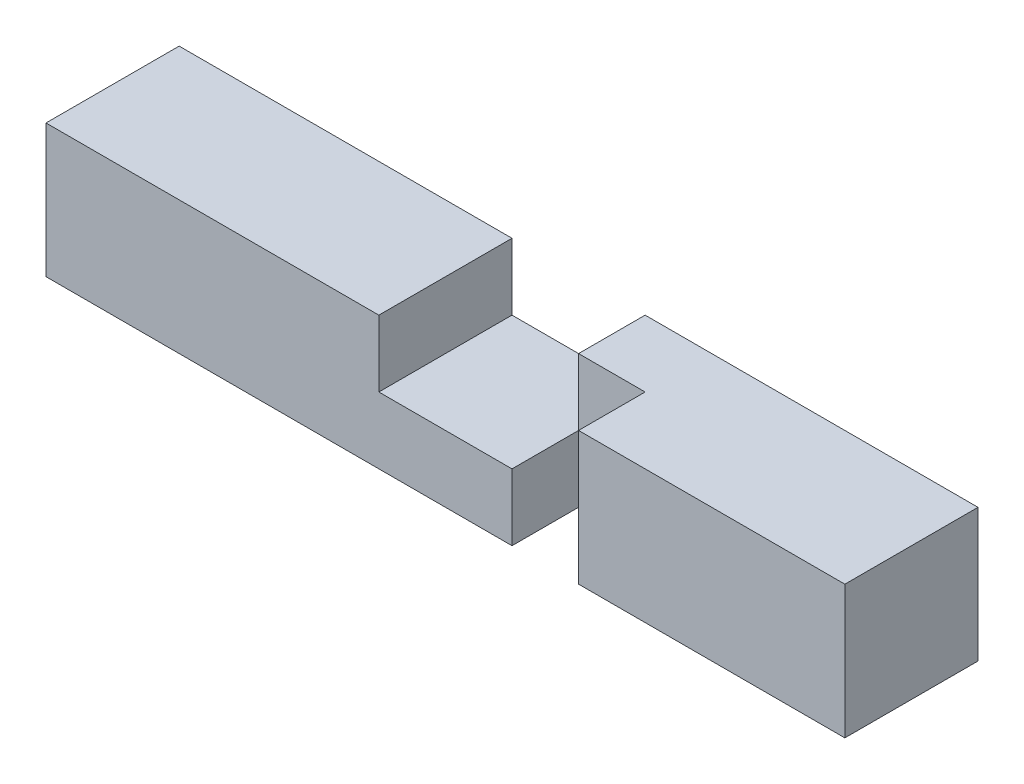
SolidWorks part; units mm, degrees
ref_plane "Front Plane" through (0, 0, 0) normal (0, 0, 1) x (1, 0, 0)
ref_plane "Top Plane" through (0, 0, 0) normal (0, 1, 0) x (1, 0, 0)
ref_plane "Right Plane" through (0, 0, 0) normal (1, 0, 0) x (0, 0, -1)
sketch "Sketch1" plane through (0, 0, 0) normal (0, 1, 0) x (1, 0, 0)
  line L1 (0, 0) -> (120, 0)
  line L2 (0, 0) -> (0, 20)
  line L3 (0, 20) -> (120, 20)
  line L4 (120, 0) -> (120, 20)
  dimension "D1" = 120
  dimension "D2" = 20
extrude "Extrude1" add sketch "Sketch1" along normal blind 20
sketch "Sketch2" plane through (0, 0, 0) normal (0, 0, 1) x (1, 0, 0)
  line L0 (0, 20) -> (120, 20) construction
  line L1 (50, 20) -> (70, 20)
  line L2 (50, 20) -> (50, 10)
  line L3 (50, 10) -> (70, 10)
  line L4 (70, 20) -> (70, 10)
  line L5 (0, 20) -> (0, 0) construction
  dimension "D1" = 10
  dimension "D2" = 50
  dimension "D3" = 20
extrude "Extrude2" cut sketch "Sketch2" against normal through all
sketch "Sketch3" plane through (0, 20, 0) normal (0, 1, 0) x (1, 0, 0)
  line L1 (70, 0) -> (80, 0)
  line L2 (70, 0) -> (70, 10)
  line L3 (70, 10) -> (80, 10)
  line L4 (80, 0) -> (80, 10)
  dimension "D1" = 10
  dimension "D2" = 10
extrude "Extrude3" cut sketch "Sketch3" against normal through all
